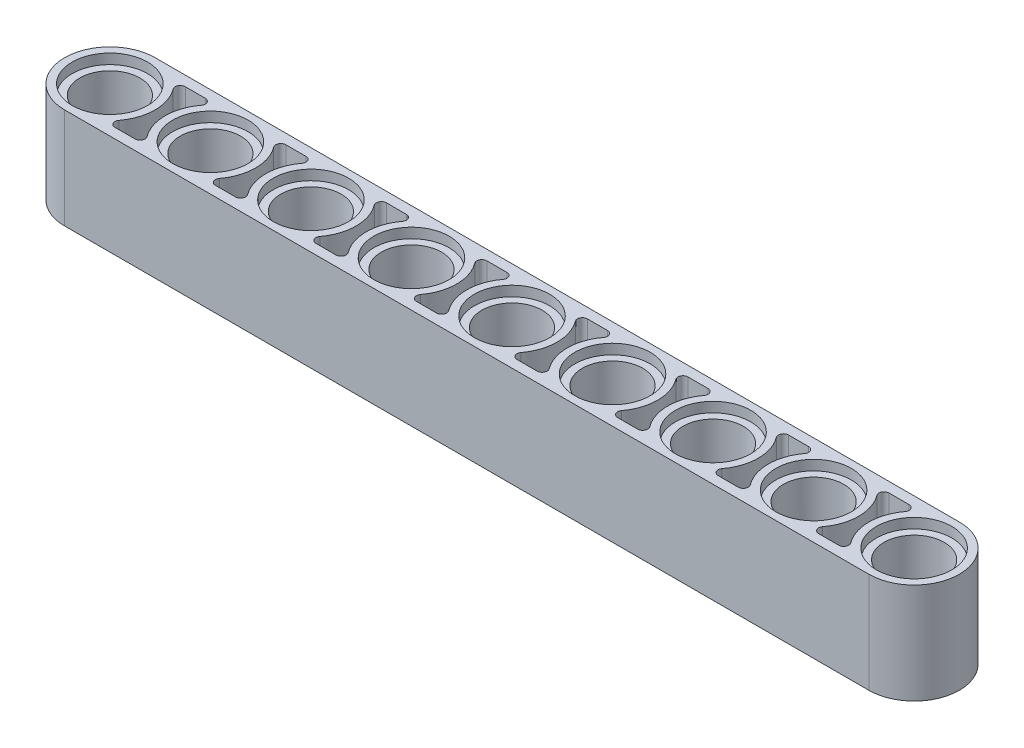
SolidWorks part; units mm, degrees
ref_plane "Front Plane" through (0, 0, 0) normal (0, 0, 1) x (1, 0, 0)
ref_plane "Top Plane" through (0, 0, 0) normal (0, 1, 0) x (1, 0, 0)
ref_plane "Right Plane" through (0, 0, 0) normal (1, 0, 0) x (0, 0, -1)
sketch "Sketch1" plane through (0, 0, 0) normal (0, 1, 0) x (1, 0, 0)
  line L0 (0, 0) -> (8, 0) construction
  line L1 (0, -3.6) -> (112, -3.6)
  line L2 (0, 3.6) -> (112, 3.6)
  circle A0 centre (0, 0) radius 2.4
  circle A1 centre (8, 0) radius 2.4
  circle A2 centre (16, 0) radius 2.4
  circle A3 centre (24, 0) radius 2.4
  circle A4 centre (32, 0) radius 2.4
  circle A5 centre (40, 0) radius 2.4
  circle A6 centre (48, 0) radius 2.4
  circle A7 centre (56, 0) radius 2.4
  circle A8 centre (64, 0) radius 2.4
  circle A9 centre (72, 0) radius 2.4
  circle A10 centre (80, 0) radius 2.4
  circle A11 centre (88, 0) radius 2.4
  circle A12 centre (96, 0) radius 2.4
  circle A13 centre (104, 0) radius 2.4
  circle A14 centre (112, 0) radius 2.4
  arc A15 (112, 3.6) -> (112, -3.6) centre (112, 0) cw
  arc A16 (0, 3.6) -> (0, -3.6) centre (0, 0) ccw
  dimension "D1" = 4.8
  dimension "D2" = 8
  dimension "D3" = 15
  dimension "D4" = 3.6
  dimension "D5" = 3.6
extrude "Boss-Extrude1" add sketch "Sketch1" along normal blind 8
sketch "Sketch2" plane through (0, 8, 0) normal (0, 1, 0) x (1, 0, 0)
  line L0 (0, 0) -> (8, 0) construction
  circle A0 centre (0, 0) radius 3
  circle A1 centre (8, 0) radius 3
  circle A2 centre (16, 0) radius 3
  circle A3 centre (24, 0) radius 3
  circle A4 centre (32, 0) radius 3
  circle A5 centre (40, 0) radius 3
  circle A6 centre (48, 0) radius 3
  circle A7 centre (56, 0) radius 3
  circle A8 centre (64, 0) radius 3
  circle A9 centre (72, 0) radius 3
  circle A10 centre (80, 0) radius 3
  circle A11 centre (88, 0) radius 3
  circle A12 centre (96, 0) radius 3
  circle A13 centre (104, 0) radius 3
  circle A14 centre (112, 0) radius 3
  dimension "D1" = 6
  dimension "D2" = 8
extrude "Cut-Extrude1" cut sketch "Sketch2" against normal blind 0.8
sketch "Sketch3" plane through (0, 8, 0) normal (0, 1, 0) x (1, 0, 0)
  line L0 (3.2, 2.8) -> (4.8, 2.8)
  line L1 (4.8, -2.8) -> (3.2, -2.8)
  line L2 (112, 3.6) -> (0, 3.6) construction
  line L3 (0, -3.6) -> (112, -3.6) construction
  line L4 (11.2, 2.8) -> (12.8, 2.8)
  line L5 (12.8, -2.8) -> (11.2, -2.8)
  line L6 (19.2, 2.8) -> (20.8, 2.8)
  line L7 (20.8, -2.8) -> (19.2, -2.8)
  line L8 (27.2, 2.8) -> (28.8, 2.8)
  line L9 (28.8, -2.8) -> (27.2, -2.8)
  line L10 (35.2, 2.8) -> (36.8, 2.8)
  line L11 (36.8, -2.8) -> (35.2, -2.8)
  line L12 (43.2, 2.8) -> (44.8, 2.8)
  line L13 (44.8, -2.8) -> (43.2, -2.8)
  line L14 (51.2, 2.8) -> (52.8, 2.8)
  line L15 (52.8, -2.8) -> (51.2, -2.8)
  line L16 (59.2, 2.8) -> (60.8, 2.8)
  line L17 (60.8, -2.8) -> (59.2, -2.8)
  line L18 (67.2, 2.8) -> (68.8, 2.8)
  line L19 (68.8, -2.8) -> (67.2, -2.8)
  line L20 (75.2, 2.8) -> (76.8, 2.8)
  line L21 (76.8, -2.8) -> (75.2, -2.8)
  line L22 (83.2, 2.8) -> (84.8, 2.8)
  line L23 (84.8, -2.8) -> (83.2, -2.8)
  line L24 (91.2, 2.8) -> (92.8, 2.8)
  line L25 (92.8, -2.8) -> (91.2, -2.8)
  line L26 (99.2, 2.8) -> (100.8, 2.8)
  line L27 (100.8, -2.8) -> (99.2, -2.8)
  line L28 (107.2, 2.8) -> (108.8, 2.8)
  line L29 (108.8, -2.8) -> (107.2, -2.8)
  line L30 (3.2, 2.8) -> (11.2, 2.8) construction
  arc A0 (2.88, -2.16) -> (2.88, 2.16) centre (0, 0) ccw
  arc A1 (5.12, 2.16) -> (5.12, -2.16) centre (8, 0) ccw
  arc A2 (3.2, -2.8) -> (2.88, -2.16) centre (3.2, -2.4) cw
  arc A3 (5.12, -2.16) -> (4.8, -2.8) centre (4.8, -2.4) cw
  arc A4 (5.12, 2.16) -> (4.8, 2.8) centre (4.8, 2.4) ccw
  arc A5 (3.2, 2.8) -> (2.88, 2.16) centre (3.2, 2.4) ccw
  arc A6 (10.88, -2.16) -> (10.88, 2.16) centre (8, 0) ccw
  arc A7 (13.12, 2.16) -> (13.12, -2.16) centre (16, 0) ccw
  arc A8 (11.2, -2.8) -> (10.88, -2.16) centre (11.2, -2.4) cw
  arc A9 (13.12, -2.16) -> (12.8, -2.8) centre (12.8, -2.4) cw
  arc A10 (13.12, 2.16) -> (12.8, 2.8) centre (12.8, 2.4) ccw
  arc A11 (11.2, 2.8) -> (10.88, 2.16) centre (11.2, 2.4) ccw
  arc A12 (18.88, -2.16) -> (18.88, 2.16) centre (16, 0) ccw
  arc A13 (21.12, 2.16) -> (21.12, -2.16) centre (24, 0) ccw
  arc A14 (19.2, -2.8) -> (18.88, -2.16) centre (19.2, -2.4) cw
  arc A15 (21.12, -2.16) -> (20.8, -2.8) centre (20.8, -2.4) cw
  arc A16 (21.12, 2.16) -> (20.8, 2.8) centre (20.8, 2.4) ccw
  arc A17 (19.2, 2.8) -> (18.88, 2.16) centre (19.2, 2.4) ccw
  arc A18 (26.88, -2.16) -> (26.88, 2.16) centre (24, 0) ccw
  arc A19 (29.12, 2.16) -> (29.12, -2.16) centre (32, 0) ccw
  arc A20 (27.2, -2.8) -> (26.88, -2.16) centre (27.2, -2.4) cw
  arc A21 (29.12, -2.16) -> (28.8, -2.8) centre (28.8, -2.4) cw
  arc A22 (29.12, 2.16) -> (28.8, 2.8) centre (28.8, 2.4) ccw
  arc A23 (27.2, 2.8) -> (26.88, 2.16) centre (27.2, 2.4) ccw
  arc A24 (34.88, -2.16) -> (34.88, 2.16) centre (32, 0) ccw
  arc A25 (37.12, 2.16) -> (37.12, -2.16) centre (40, 0) ccw
  arc A26 (35.2, -2.8) -> (34.88, -2.16) centre (35.2, -2.4) cw
  arc A27 (37.12, -2.16) -> (36.8, -2.8) centre (36.8, -2.4) cw
  arc A28 (37.12, 2.16) -> (36.8, 2.8) centre (36.8, 2.4) ccw
  arc A29 (35.2, 2.8) -> (34.88, 2.16) centre (35.2, 2.4) ccw
  arc A30 (42.88, -2.16) -> (42.88, 2.16) centre (40, 0) ccw
  arc A31 (45.12, 2.16) -> (45.12, -2.16) centre (48, 0) ccw
  arc A32 (43.2, -2.8) -> (42.88, -2.16) centre (43.2, -2.4) cw
  arc A33 (45.12, -2.16) -> (44.8, -2.8) centre (44.8, -2.4) cw
  arc A34 (45.12, 2.16) -> (44.8, 2.8) centre (44.8, 2.4) ccw
  arc A35 (43.2, 2.8) -> (42.88, 2.16) centre (43.2, 2.4) ccw
  arc A36 (50.88, -2.16) -> (50.88, 2.16) centre (48, 0) ccw
  arc A37 (53.12, 2.16) -> (53.12, -2.16) centre (56, 0) ccw
  arc A38 (51.2, -2.8) -> (50.88, -2.16) centre (51.2, -2.4) cw
  arc A39 (53.12, -2.16) -> (52.8, -2.8) centre (52.8, -2.4) cw
  arc A40 (53.12, 2.16) -> (52.8, 2.8) centre (52.8, 2.4) ccw
  arc A41 (51.2, 2.8) -> (50.88, 2.16) centre (51.2, 2.4) ccw
  arc A42 (58.88, -2.16) -> (58.88, 2.16) centre (56, 0) ccw
  arc A43 (61.12, 2.16) -> (61.12, -2.16) centre (64, 0) ccw
  arc A44 (59.2, -2.8) -> (58.88, -2.16) centre (59.2, -2.4) cw
  arc A45 (61.12, -2.16) -> (60.8, -2.8) centre (60.8, -2.4) cw
  arc A46 (61.12, 2.16) -> (60.8, 2.8) centre (60.8, 2.4) ccw
  arc A47 (59.2, 2.8) -> (58.88, 2.16) centre (59.2, 2.4) ccw
  arc A48 (66.88, -2.16) -> (66.88, 2.16) centre (64, 0) ccw
  arc A49 (69.12, 2.16) -> (69.12, -2.16) centre (72, 0) ccw
  arc A50 (67.2, -2.8) -> (66.88, -2.16) centre (67.2, -2.4) cw
  arc A51 (69.12, -2.16) -> (68.8, -2.8) centre (68.8, -2.4) cw
  arc A52 (69.12, 2.16) -> (68.8, 2.8) centre (68.8, 2.4) ccw
  arc A53 (67.2, 2.8) -> (66.88, 2.16) centre (67.2, 2.4) ccw
  arc A54 (74.88, -2.16) -> (74.88, 2.16) centre (72, 0) ccw
  arc A55 (77.12, 2.16) -> (77.12, -2.16) centre (80, 0) ccw
  arc A56 (75.2, -2.8) -> (74.88, -2.16) centre (75.2, -2.4) cw
  arc A57 (77.12, -2.16) -> (76.8, -2.8) centre (76.8, -2.4) cw
  arc A58 (77.12, 2.16) -> (76.8, 2.8) centre (76.8, 2.4) ccw
  arc A59 (75.2, 2.8) -> (74.88, 2.16) centre (75.2, 2.4) ccw
  arc A60 (82.88, -2.16) -> (82.88, 2.16) centre (80, 0) ccw
  arc A61 (85.12, 2.16) -> (85.12, -2.16) centre (88, 0) ccw
  arc A62 (83.2, -2.8) -> (82.88, -2.16) centre (83.2, -2.4) cw
  arc A63 (85.12, -2.16) -> (84.8, -2.8) centre (84.8, -2.4) cw
  arc A64 (85.12, 2.16) -> (84.8, 2.8) centre (84.8, 2.4) ccw
  arc A65 (83.2, 2.8) -> (82.88, 2.16) centre (83.2, 2.4) ccw
  arc A66 (90.88, -2.16) -> (90.88, 2.16) centre (88, 0) ccw
  arc A67 (93.12, 2.16) -> (93.12, -2.16) centre (96, 0) ccw
  arc A68 (91.2, -2.8) -> (90.88, -2.16) centre (91.2, -2.4) cw
  arc A69 (93.12, -2.16) -> (92.8, -2.8) centre (92.8, -2.4) cw
  arc A70 (93.12, 2.16) -> (92.8, 2.8) centre (92.8, 2.4) ccw
  arc A71 (91.2, 2.8) -> (90.88, 2.16) centre (91.2, 2.4) ccw
  arc A72 (98.88, -2.16) -> (98.88, 2.16) centre (96, 0) ccw
  arc A73 (101.12, 2.16) -> (101.12, -2.16) centre (104, 0) ccw
  arc A74 (99.2, -2.8) -> (98.88, -2.16) centre (99.2, -2.4) cw
  arc A75 (101.12, -2.16) -> (100.8, -2.8) centre (100.8, -2.4) cw
  arc A76 (101.12, 2.16) -> (100.8, 2.8) centre (100.8, 2.4) ccw
  arc A77 (99.2, 2.8) -> (98.88, 2.16) centre (99.2, 2.4) ccw
  arc A78 (106.88, -2.16) -> (106.88, 2.16) centre (104, 0) ccw
  arc A79 (109.12, 2.16) -> (109.12, -2.16) centre (112, 0) ccw
  arc A80 (107.2, -2.8) -> (106.88, -2.16) centre (107.2, -2.4) cw
  arc A81 (109.12, -2.16) -> (108.8, -2.8) centre (108.8, -2.4) cw
  arc A82 (109.12, 2.16) -> (108.8, 2.8) centre (108.8, 2.4) ccw
  arc A83 (107.2, 2.8) -> (106.88, 2.16) centre (107.2, 2.4) ccw
  dimension "D3" = 0.4
  dimension "D1" = 0.8
  dimension "D2" = 0.8
  dimension "D4" = 8
extrude "Cut-Extrude2" cut sketch "Sketch3" against normal blind 3.2
ref_plane "Plane1" through (0, 4, 0) normal (0, 1, 0) x (1, 0, 0)
mirror "Mirror1" about plane through (0, 4, 0) normal (0, 1, 0) of "Cut-Extrude2", "Cut-Extrude1"
sketch "Sketch4" plane through (0, 8, 0) normal (0, 1, 0) x (1, 0, 0)
  line L0 (96, 3.6) -> (112, 3.6)
  line L1 (112, -3.6) -> (96, -3.6)
  arc A0 (96, -3.6) -> (96, 3.6) centre (96, 0) ccw
  arc A1 (112, -3.6) -> (112, 3.6) centre (112, 0) ccw construction
  arc A2 (112, -3.6) -> (112, 3.6) centre (112, 0) ccw
extrude "Cut-Extrude3" cut sketch "Sketch4" against normal up to surface (8 mm away)
sketch "Sketch5" plane through (0, 8, 0) normal (0, 1, 0) x (1, 0, 0)
  line L1 (80, 3.6) -> (96, 3.6)
  line L2 (80, -3.6) -> (96, -3.6)
  arc A1 (96, -3.6) -> (96, 3.6) centre (96, 0) ccw
  arc A2 (80, 3.6) -> (80, -3.6) centre (80, 0) cw
  point P4 (88, 0)
extrude "Cut-Extrude4" cut sketch "Sketch5" against normal up to surface (8 mm away)
sketch "Sketch6" plane through (0, 8, 0) normal (0, 1, 0) x (1, 0, 0)
  line L0 (64, 3.6) -> (80, 3.6)
  line L2 (80, -3.6) -> (64, -3.6)
  arc A0 (64, -3.6) -> (64, 3.6) centre (64, 0) ccw
  arc A1 (80, 3.6) -> (80, -3.6) centre (80, 0) cw
extrude "Cut-Extrude5" cut sketch "Sketch6" against normal up to surface (8 mm away)
